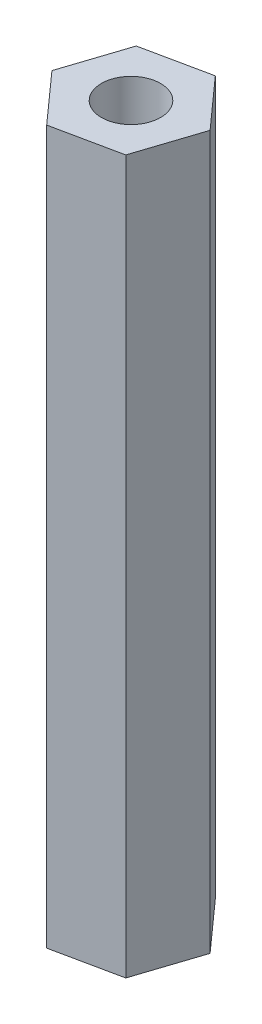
SolidWorks part; units mm, degrees
ref_plane "Front Plane" through (0, 0, 0) normal (0, 0, 1) x (1, 0, 0)
ref_plane "Top Plane" through (0, 0, 0) normal (0, 1, 0) x (1, 0, 0)
ref_plane "Right Plane" through (0, 0, 0) normal (1, 0, 0) x (0, 0, -1)
sketch "Sketch2" plane through (0, 0, 0) normal (0, 1, 0) x (1, 0, 0)
  line L1 (-1.1696, -3.562) -> (2.5, -2.7939)
  line L2 (2.5, -2.7939) -> (3.6696, 0.7681)
  line L3 (3.6696, 0.7681) -> (1.1696, 3.562)
  line L4 (1.1696, 3.562) -> (-2.5, 2.7939)
  line L5 (-2.5, 2.7939) -> (-3.6696, -0.7681)
  line L6 (-3.6696, -0.7681) -> (-1.1696, -3.562)
  circle A0 centre (0, 0) radius 1.66
  circle A1 centre (0, 0) radius 3.2468 construction
  dimension "D1" = 3.32
  dimension "D2" = 5
extrude "Boss-Extrude1" add sketch "Sketch2" along normal blind 40
